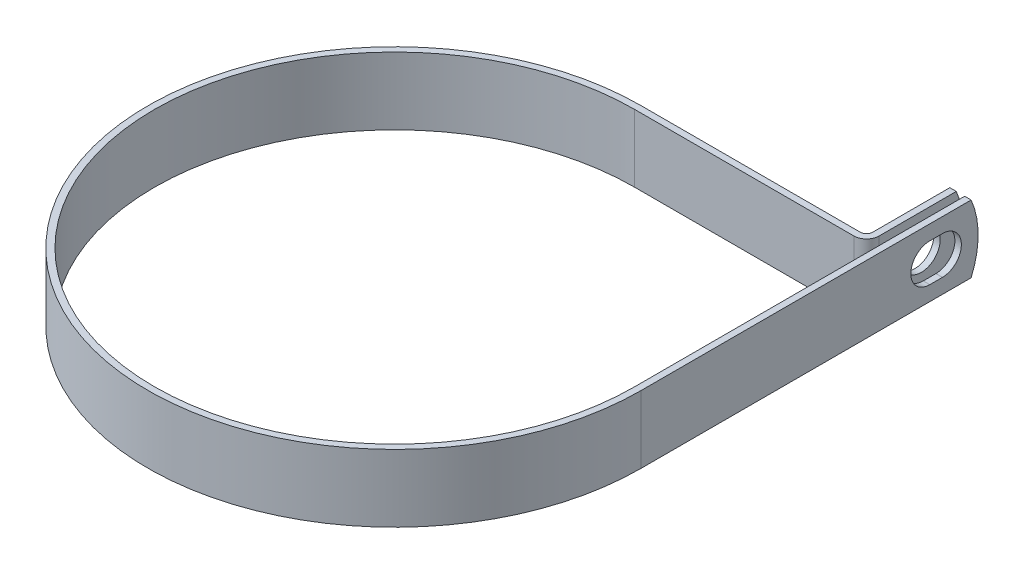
SolidWorks part; units mm, degrees
ref_plane "Front Plane" through (0, 0, 0) normal (0, 0, 1) x (1, 0, 0)
ref_plane "Top Plane" through (0, 0, 0) normal (0, 1, 0) x (1, 0, 0)
ref_plane "Right Plane" through (0, 0, 0) normal (1, 0, 0) x (0, 0, -1)
sketch "Sketch1" plane through (0, 0, 0) normal (0, 1, 0) x (1, 0, 0)
  line L0 (0, 45.2374) -> (41.2852, 45.2374)
  line L1 (45.2374, 0) -> (45.2374, 45.2374)
  line L2 (43.6626, 63.4746) -> (43.6626, 47.6148)
  line L5 (45.2374, 45.2374) -> (45.2374, 63.4746)
  arc A0 (0, 45.2374) -> (45.2374, 0) centre (0, 0) ccw
  arc A3 (41.2852, 45.2374) -> (43.6626, 47.6148) centre (41.2852, 47.6148) ccw
extrude "Extrude-Thin1" add sketch "Sketch1" along normal mid plane 12.7 thin
sketch "Sketch2" plane through (42.4434, 0, 0) normal (-1, 0, 0) x (0, 0, 1)
  line L0 (-63.4746, 6.35) -> (-63.4746, -6.35) construction
  line L7 (0, 6.35) -> (0, -6.35) construction
  circle A0 centre (-55.5498, 0) radius 3.5687
  point P2 (-63.4746, 0)
extrude "Cut-Extrude1" cut sketch "Sketch2" against normal up to surface (1.2192 mm away)
sketch "Sketch3" plane through (46.4566, 0, 0) normal (1, 0, 0) x (0, 0, -1)
  line L0 (54.356, 0) -> (56.7436, 0) construction
  line L1 (54.356, 3.5687) -> (56.7436, 3.5687)
  line L2 (54.356, -3.5687) -> (56.7436, -3.5687)
  line L3 (63.4746, 6.35) -> (63.4746, -6.35) construction
  arc A0 (54.356, 3.5687) -> (54.356, -3.5687) centre (54.356, 0) ccw
  arc A1 (56.7436, -3.5687) -> (56.7436, 3.5687) centre (56.7436, 0) ccw
  point P3 (55.5498, 0)
  point P8 (63.4746, 0)
  point P11 (50.7873, 0)
  point P12 (60.3123, 0)
extrude "Cut-Extrude2" cut sketch "Sketch3" against normal up to surface (1.2192 mm away)
sketch "Sketch4" plane through (42.4434, 0, 0) normal (-1, 0, 0) x (0, 0, 1)
  line L0 (-63.4746, 6.35) -> (-63.4746, -6.35)
  line L1 (-63.4746, 6.35) -> (-62.1493, 6.35)
  line L2 (-63.4746, 6.35) -> (-47.6148, 6.35) construction
  line L3 (-63.4746, -6.35) -> (-62.1493, -6.35)
  line L4 (-63.4746, -6.35) -> (-47.6148, -6.35) construction
  arc A0 (-62.1493, 6.35) -> (-62.1493, -6.35) centre (-47.5996, 0) ccw
extrude "Cut-Extrude3" cut sketch "Sketch4" against normal through all contours A0 M4 M5 | A0 L0 M2
equation "\"D1@Sketch3\" = \"D2@Sketch2\""
equation "\"D7@Sketch1\" = \"D3@Sketch2\" + \"D1@Sketch3\""
equation "\"D1@Sketch4\" = ( \"D1@Extrude-Thin1\" + .125 ) * 2"
equation "\"D2@Sketch1\"=1.95*\"D5@Extrude-Thin1\""
equation "\"D2@Sketch3\" = \"D1@Sketch2\""
